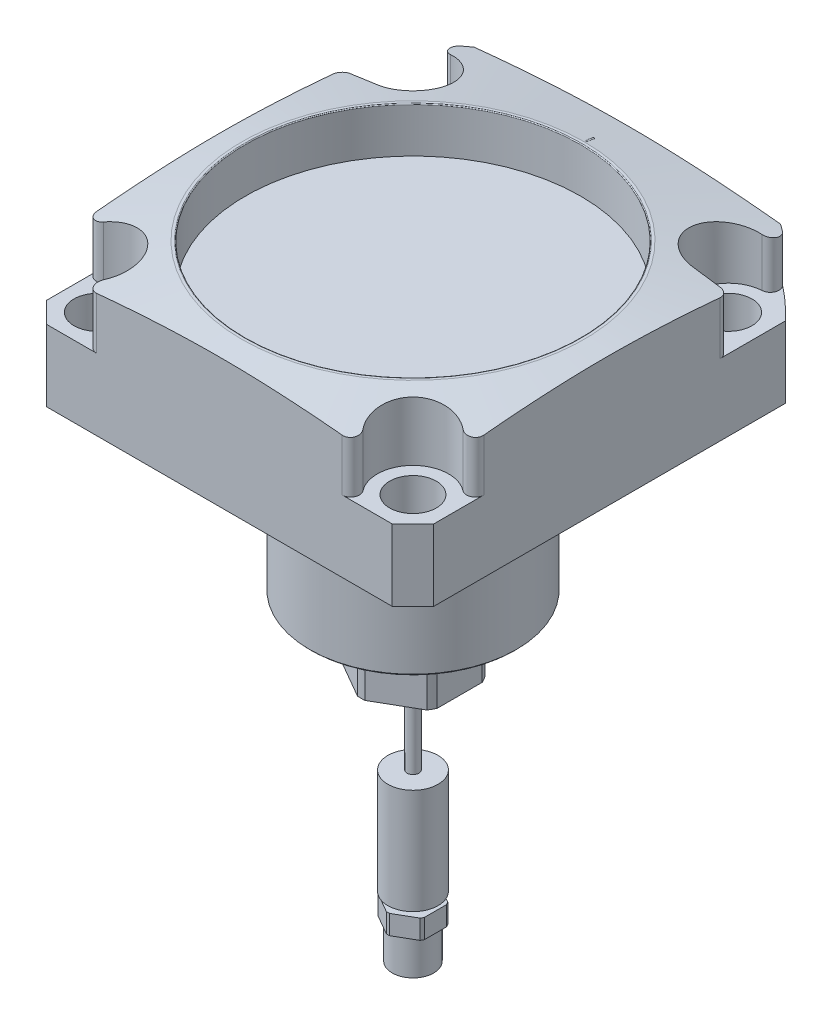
SolidWorks part; units mm, degrees
ref_plane "Front Plane" through (0, 0, 0) normal (0, 0, 1) x (1, 0, 0)
ref_plane "Top Plane" through (0, 0, 0) normal (0, 1, 0) x (1, 0, 0)
ref_plane "Right Plane" through (0, 0, 0) normal (1, 0, 0) x (0, 0, -1)
sketch "Sketch6" plane through (0, 0, 0) normal (0, 0, 1) x (1, 0, 0)
  line L0 (0, -8.9689) -> (0, 71.3762) construction
  line L1 (48.514, 38.6207) -> (49.5046, 38.6207)
  line L2 (49.5046, 38.6207) -> (76.2, 33.9136)
  line L3 (76.2, 33.9136) -> (76.2, 0)
  line L4 (76.2, 0) -> (29.8831, 0)
  line L5 (29.8831, 0) -> (29.8831, -49.3903)
  line L6 (29.8831, -49.3903) -> (0, -49.3903)
  line L7 (0, -49.3903) -> (0, 25.5007)
  line L8 (48.514, 38.6207) -> (48.514, 25.5007)
  line L9 (48.514, 25.5007) -> (0, 25.5007)
  dimension "D1" = 59.7662
  dimension "D2" = 38.6207
  dimension "D3" = 49.3903
  dimension "D4" = 152.4
  dimension "D5" = 10
  dimension "D6" = 99.0092
  dimension "D7" = 13.12
  dimension "D8" = 97.028
  dimension "D9" = 88.011
  dimension "D10" = 4.7071
revolve "Revolve3" add sketch "Sketch6" angle 360 about L0
fillet "Fillet7" radius 0.254 1 edges at (0, 38.6207, -48.514)
sketch "Sketch7" plane through (0, 0, 0) normal (0, -1, 0) x (1, 0, 0)
  line L0 (0, 0) -> (0, -52.3237) construction
  line L1 (-50, 56) -> (50, 56)
  line L2 (-56, 50) -> (-56, -62)
  line L3 (-56, -62) -> (56, -62)
  line L4 (56, 50) -> (56, -62)
  line L5 (50, 56) -> (56, 50)
  line L6 (-56, 50) -> (-50, 56)
  point P0 (-56, 56)
  point P3 (56, 56)
extrude "Cut-Extrude5" cut sketch "Sketch7" against normal through all flip side to cut
sketch "Sketch8" plane through (0, 0, 0) normal (0, -1, 0) x (1, 0, 0)
  circle A0 centre (-45.6438, 45.6438) radius 6.7437
extrude "Cut-Extrude6" cut sketch "Sketch8" against normal through all
pattern_circular "CirPattern2" count 4 over 360 about axis through (0, 0, 0) along (0, 1, 0) of "Cut-Extrude6"
sketch "Sketch9" plane through (0, 38.6207, 0) normal (0, 1, 0) x (1, 0, 0)
  line L0 (-56, -50) -> (-50, -56) construction
  line L1 (-50, -56) -> (50, -56) construction
  line L2 (56, 55.9689) -> (56, 35.3187)
  line L3 (-56, -50) -> (-50, -56)
  line L4 (56, 35.3187) -> (45.6438, 35.3187)
  line L5 (45.6438, 55.9689) -> (56, 55.9689)
  line L6 (-45.6438, 55.9689) -> (-56, 55.9689)
  line L7 (-56, 51.6763) -> (-56, -50) construction
  line L8 (-56, 35.3187) -> (-45.6438, 35.3187)
  line L9 (-56, 55.9689) -> (-56, 35.3187)
  line L10 (-50, -56) -> (-41.3981, -56)
  line L11 (0, 0) -> (0, 26.6366) construction
  line L13 (-56, -41.3981) -> (-52.9447, -38.3429)
  line L14 (-38.3429, -52.9447) -> (-41.3981, -56)
  line L15 (-56, -41.3981) -> (-56, -50)
  line L16 (56, -41.3981) -> (56, -50)
  line L17 (38.3429, -52.9447) -> (41.3981, -56)
  line L18 (56, -41.3981) -> (52.9448, -38.3429)
  line L19 (50, -56) -> (41.3981, -56)
  line L20 (56, -50) -> (50, -56)
  arc A0 (-38.3429, -52.9447) -> (-52.9447, -38.3429) centre (-45.6438, -45.6438) ccw
  arc A1 (-45.6438, 35.3187) -> (-45.6438, 55.9689) centre (-45.6438, 45.6438) ccw
  arc A2 (38.3429, -52.9447) -> (52.9448, -38.3429) centre (45.6438, -45.6438) cw
  arc A3 (45.6438, 35.3187) -> (45.6438, 55.9689) centre (45.6438, 45.6438) cw
  dimension "D1" = 20.6502
extrude "Cut-Extrude7" cut sketch "Sketch9" against normal offset from surface (17.9705 mm away) 20.6502
fillet "Fillet4" radius 2.4892 8 edges at (-56, 28.1629, -35.3187) (41.3981, 27.8602, 56) (-41.3981, 27.8602, 56) (-56, 27.8602, 41.3981) (51.71, 27.2819, -55.9689) (-51.71, 27.2819, -55.9689)
fillet "Fillet5" radius 0.4 1 edges at (0, 0, -29.8831)
chamfer "Chamfer2" distance 0.5 angle 45 1 edges at (0, -49.3903, -29.8831)
ref_plane "Plane1" through (0, 18.6436, 0) normal (0, -1, 0) x (1, 0, 0)
sketch "Sketch11" plane through (0, 18.6436, 0) normal (0, -1, 0) x (1, 0, 0)
  line L0 (-20, -4.7006) -> (-20, -58.3255) construction
  line L1 (-44.2994, -62) -> (44.2994, -62) construction
  line L2 (-26.1849, -61.75) -> (-25.6396, -59.1846)
  line L3 (-25.6396, -59.1846) -> (-24.9784, -58.5234)
  line L10 (-20, -62) -> (-30.4775, -62)
  line L11 (-20, -42.7) -> (-20, -62)
  line L12 (-24.9784, -42.7) -> (-20, -42.7)
  line L13 (-24.9784, -58.5234) -> (-24.9784, -42.7)
  line L15 (-30.4775, -61.75) -> (-26.1849, -61.75)
  line L16 (-30.4775, -62) -> (-30.4775, -61.75)
  dimension "D1" = 20
  dimension "D2" = 0.25
  dimension "D3" = 19.05
  dimension "D4" = 9.9568
  dimension "D5" = 20.955
  dimension "D6" = 12
  dimension "D7" = 12.3698
  dimension "D8" = 45
  dimension "D9" = 2.5654
revolve "Cut-Revolve5" cut sketch "Sketch11" angle 360 about L0
ref_plane "Plane2" through (0, 0, -52.7558) normal (0, 0, 1) x (1, 0, 0)
sketch "Sketch13" plane through (0, 0, -52.7558) normal (0, 0, 1) x (1, 0, 0)
  line L0 (-23.4442, 17.653) -> (-23.4442, 5.3993)
  line L1 (-24.5618, 2.6416) -> (-24.1191, 4.7244)
  line L2 (-24.5618, 2.6416) -> (-27.9273, 2.6416)
  line L3 (-27.9273, 2.6416) -> (-27.9273, 0)
  line L4 (-30.2831, 0) -> (30.2831, 0) construction
  line L5 (-27.9273, 0) -> (-19.9898, 0)
  line L6 (-19.9898, 0) -> (-19.9898, 17.653)
  line L7 (-19.9898, 17.653) -> (-23.4442, 17.653)
  line L8 (-19.9898, 15.2099) -> (-19.9898, -4.3918) construction
  line L9 (-24.1191, 4.7244) -> (-23.4442, 5.3993)
  dimension "D1" = 19.9898
  dimension "D2" = 6.9088
  dimension "D3" = 15.0114
  dimension "D4" = 2.6416
  dimension "D5" = 15.875
  dimension "D6" = 45
  dimension "D7" = 2.0828
  dimension "D8" = 12
  dimension "D9" = 9.144
revolve "Cut-Revolve6" cut sketch "Sketch13" angle 360 about L8
mirror "Mirror4" about plane through (0, 0, 0) normal (1, 0, 0) of "Cut-Revolve5", "Cut-Revolve6"
sketch "Sketch16" plane through (0, 0, -52.7558) normal (0, 0, 1) x (1, 0, 0)
  line L0 (-24.5618, 0.8763) -> (-24.5618, -0.889) construction
  line L1 (-19.9898, 9.3219) -> (-19.9898, -15.1063) construction
  line L2 (-19.9898, 5.3993) -> (-19.9898, 15.0685) construction
  line L4 (-24.5618, -0.889) -> (-26.3271, -0.889) construction
  line L5 (-24.5618, 2.6416) -> (-15.4178, 2.6416) construction
  circle A0 centre (-26.3271, 0.8763) radius 1.7653
revolve "Revolve7" add sketch "Sketch16" angle 360 about L1
mirror "Mirror3" about plane through (0, 0, 0) normal (1, 0, 0)
sketch "Sketch17" plane through (0, 0, 0) normal (1, 0, 0) x (0, 0, -1)
  line L0 (40.1487, 41.0421) -> (43.5332, 40.4453) construction
  line L1 (62, 36.4174) -> (49.5046, 38.6207) construction
  line L2 (49.997, 38.5339) -> (51.9666, 38.1866) construction
  line L3 (50.375, 39.239) -> (52.3446, 38.8917) construction
  line L5 (50.2361, 38.4511) -> (52.2057, 38.1038)
  line L6 (49.5871, 39.3779) -> (53.1324, 38.7527)
  arc A0 (49.5871, 39.3779) -> (50.2361, 38.4511) centre (50.375, 39.239) ccw
  arc A1 (52.2057, 38.1038) -> (53.1324, 38.7527) centre (52.3446, 38.8917) ccw
  dimension "D1" = 1.6
  dimension "D2" = 2
  dimension "D3" = 0.5
  dimension "D4" = 0.76
  dimension "D5" = 0.04
revolve "Cut-Revolve7" cut sketch "Sketch17" angle 360 about L6
sketch "Sketch19" plane through (2.8042, -49.3903, 1.1774) normal (0, -1, 0) x (1, 0, 0)
  circle A0 centre (-2.8042, -1.1774) radius 23.2537
  dimension "D1" = 46.5074
extrude "Boss-Extrude1" add sketch "Sketch19" along normal blind 0.0254
sketch "Sketch21" plane through (1.9841, -49.4157, 5.5634) normal (0, -1, 0) x (1, 0, 0)
  line L1 (0.0196, -23.588) -> (12.6237, -16.311)
  line L2 (14.6275, -12.8404) -> (14.6275, 1.7136)
  line L3 (12.6237, 5.1841) -> (0.0196, 12.4611)
  line L4 (-3.9879, 12.4611) -> (-16.592, 5.1841)
  line L5 (-18.5957, 1.7136) -> (-18.5957, -12.8404)
  line L6 (-16.592, -16.311) -> (-3.9879, -23.588)
  circle A0 centre (-1.9841, -5.5634) radius 16.6116 construction
  arc A1 (0.0196, 12.4611) -> (-3.9879, 12.4611) centre (-1.9841, -5.5634) ccw
  arc A2 (-16.592, 5.1841) -> (-18.5957, 1.7136) centre (-1.9841, -5.5634) ccw
  arc A3 (-18.5957, -12.8404) -> (-16.592, -16.311) centre (-1.9841, -5.5634) ccw
  arc A4 (-3.9879, -23.588) -> (0.0196, -23.588) centre (-1.9841, -5.5634) ccw
  arc A5 (12.6237, -16.311) -> (14.6275, -12.8404) centre (-1.9841, -5.5634) ccw
  arc A6 (14.6275, 1.7136) -> (12.6237, 5.1841) centre (-1.9841, -5.5634) ccw
  dimension "D2" = 36.2712
  dimension "D1" = 33.2232
extrude "Boss-Extrude2" add sketch "Sketch21" along normal blind 7.3406
sketch "Sketch23" plane through (1.9841, -56.7563, 5.5634) normal (0, -1, 0) x (1, 0, 0)
  line L1 (11.516, -12.0986) -> (11.516, 0.9717)
  line L2 (10.4255, 2.8604) -> (-0.8937, 9.3956)
  line L3 (-3.0746, 9.3956) -> (-14.3938, 2.8604)
  line L4 (-15.4842, 0.9717) -> (-15.4842, -12.0986)
  line L5 (-14.3938, -13.9873) -> (-3.0746, -20.5225)
  line L6 (-0.8937, -20.5225) -> (10.4255, -13.9873)
  circle A0 centre (-1.9841, -5.5634) radius 13.5001 construction
  arc A1 (-0.8937, 9.3956) -> (-3.0746, 9.3956) centre (-1.9841, -5.5634) ccw
  arc A2 (11.516, 0.9717) -> (10.4255, 2.8604) centre (-1.9841, -5.5634) ccw
  arc A3 (10.4255, -13.9873) -> (11.516, -12.0986) centre (-1.9841, -5.5634) ccw
  arc A4 (-3.0746, -20.5225) -> (-0.8937, -20.5225) centre (-1.9841, -5.5634) ccw
  arc A5 (-15.4842, -12.0986) -> (-14.3938, -13.9873) centre (-1.9841, -5.5634) ccw
  arc A6 (-14.3938, 2.8604) -> (-15.4842, 0.9717) centre (-1.9841, -5.5634) ccw
  dimension "D2" = 29.9974
  dimension "D1" = 27.0002
extrude "Boss-Extrude3" add sketch "Sketch23" along normal blind 11.7856
sketch "Sketch25" plane through (1.9841, -68.5419, 5.5634) normal (0, -1, 0) x (1, 0, 0)
  circle A0 centre (-1.9841, -5.5634) radius 1.7018
  dimension "D1" = 3.4036
extrude "Boss-Extrude4" add sketch "Sketch25" along normal blind 25.4
sketch "Sketch27" plane through (1.9841, -93.9419, 5.5634) normal (0, -1, 0) x (1, 0, 0)
  circle A0 centre (-1.9841, -5.5634) radius 7.2517
  dimension "D1" = 14.5034
extrude "Boss-Extrude5" add sketch "Sketch27" along normal blind 30.4038
sketch "Sketch29" plane through (1.9841, -124.3457, 5.5634) normal (0, -1, 0) x (1, 0, 0)
  circle A0 centre (-1.9841, -5.5634) radius 4.2545
  dimension "D1" = 8.509
extrude "Boss-Extrude6" add sketch "Sketch29" along normal blind 1.7018
sketch "Sketch31" plane through (1.9841, -126.0475, 5.5634) normal (0, -1, 0) x (1, 0, 0)
  line L1 (-8.4865, -2.3532) -> (-8.4865, -8.7737)
  line L2 (-8.0155, -9.5895) -> (-2.4551, -12.7998)
  line L3 (-1.5131, -12.7998) -> (4.0473, -9.5895)
  line L4 (4.5183, -8.7737) -> (4.5183, -2.3532)
  line L5 (4.0473, -1.5373) -> (-1.5131, 1.6729)
  line L6 (-2.4551, 1.6729) -> (-8.0155, -1.5373)
  circle A0 centre (-1.9841, -5.5634) radius 6.5024 construction
  arc A1 (-8.4865, -8.7737) -> (-8.0155, -9.5895) centre (-1.9841, -5.5634) ccw
  arc A2 (-8.0155, -1.5373) -> (-8.4865, -2.3532) centre (-1.9841, -5.5634) ccw
  arc A3 (-1.5131, 1.6729) -> (-2.4551, 1.6729) centre (-1.9841, -5.5634) ccw
  arc A4 (4.5183, -2.3532) -> (4.0473, -1.5373) centre (-1.9841, -5.5634) ccw
  arc A5 (4.0473, -9.5895) -> (4.5183, -8.7737) centre (-1.9841, -5.5634) ccw
  arc A6 (-2.4551, -12.7998) -> (-1.5131, -12.7998) centre (-1.9841, -5.5634) ccw
  dimension "D2" = 14.5034
  dimension "D1" = 13.0048
extrude "Boss-Extrude7" add sketch "Sketch31" along normal blind 5.588
sketch "Sketch33" plane through (1.9841, -131.6355, 5.5634) normal (0, -1, 0) x (1, 0, 0)
  circle A0 centre (-1.9841, -5.5634) radius 5.9944
  dimension "D1" = 11.9888
extrude "Boss-Extrude8" add sketch "Sketch33" along normal blind 10.2108
equation "\"D3@Sketch7\"=\"D5@Sketch7\""
equation "\"D2@Sketch8\"=\"D3@Sketch8\""
equation "\"D3@Sketch16\"=\"D1@Sketch16\"/2"
